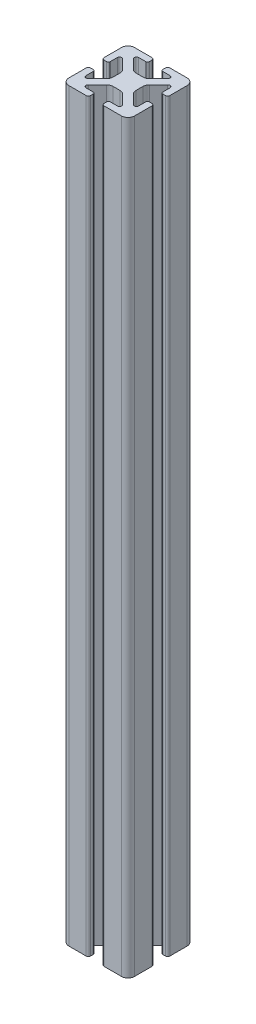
SolidWorks part; units mm, degrees
ref_plane "Front Plane" through (0, 0, 0) normal (0, 0, 1) x (1, 0, 0)
ref_plane "Top Plane" through (0, 0, 0) normal (0, 1, 0) x (1, 0, 0)
ref_plane "Right Plane" through (0, 0, 0) normal (1, 0, 0) x (0, 0, -1)
imported_body "item_0041901_Profile_6_30x30_L=20_1.stp"
sketch "Sketch1" plane through (0, 10, 0) normal (0, 1, 0) x (1, 0, 0)
  line L36 (3.1, 14) -> (3.1, 12.8)
  line L37 (3.9, 12) -> (7.1276, 12)
  line L38 (7.8506, 10.2547) -> (3.7245, 6.1287)
  line L39 (1.6032, 5.25) -> (-1.6032, 5.25)
  line L40 (-3.7245, 6.1287) -> (-7.8506, 10.2547)
  line L41 (-7.1276, 12) -> (-3.9, 12)
  line L42 (-3.1, 12.8) -> (-3.1, 14)
  line L43 (-4.1, 15) -> (-12, 15)
  line L44 (-15, 12) -> (-15, 4.1)
  line L45 (-14, 3.1) -> (-12.8, 3.1)
  line L46 (-12, 3.9) -> (-12, 7.1276)
  line L47 (-10.2547, 7.8506) -> (-6.1287, 3.7245)
  line L48 (-5.25, 1.6032) -> (-5.25, -1.6032)
  line L49 (-6.1287, -3.7245) -> (-10.2547, -7.8506)
  line L50 (-12, -7.1276) -> (-12, -3.9)
  line L51 (-12.8, -3.1) -> (-14, -3.1)
  line L52 (-15, -4.1) -> (-15, -12)
  line L53 (-12, -15) -> (-4.1, -15)
  line L54 (-3.1, -14) -> (-3.1, -12.8)
  line L55 (-3.9, -12) -> (-7.1276, -12)
  line L56 (-7.8506, -10.2547) -> (-3.7245, -6.1287)
  line L57 (-1.6032, -5.25) -> (1.6032, -5.25)
  line L58 (3.7245, -6.1287) -> (7.8506, -10.2547)
  line L59 (7.1276, -12) -> (3.9, -12)
  line L60 (3.1, -12.8) -> (3.1, -14)
  line L61 (4.1, -15) -> (12, -15)
  line L62 (15, -12) -> (15, -4.1)
  line L63 (14, -3.1) -> (12.8, -3.1)
  line L64 (12, -3.9) -> (12, -7.1276)
  line L65 (10.2547, -7.8506) -> (6.1287, -3.7245)
  line L66 (5.25, -1.6032) -> (5.25, 1.6032)
  line L67 (6.1287, 3.7245) -> (10.2547, 7.8506)
  line L68 (12, 7.1276) -> (12, 3.9)
  line L69 (12.8, 3.1) -> (14, 3.1)
  line L70 (15, 4.1) -> (15, 12)
  line L71 (12, 15) -> (4.1, 15)
  line L72 (3.1, 14) -> (3.1, 12.8)
  line L73 (3.9, 12) -> (7.1276, 12)
  line L74 (7.8506, 10.2547) -> (3.7245, 6.1287)
  line L75 (1.6032, 5.25) -> (-1.6032, 5.25)
  line L76 (-3.7245, 6.1287) -> (-7.8506, 10.2547)
  line L77 (-7.1276, 12) -> (-3.9, 12)
  line L78 (-3.1, 12.8) -> (-3.1, 14)
  line L79 (-4.1, 15) -> (-12, 15)
  line L80 (-15, 12) -> (-15, 4.1)
  line L81 (-14, 3.1) -> (-12.8, 3.1)
  line L82 (-12, 3.9) -> (-12, 7.1276)
  line L83 (-10.2547, 7.8506) -> (-6.1287, 3.7245)
  line L84 (-5.25, 1.6032) -> (-5.25, -1.6032)
  line L85 (-6.1287, -3.7245) -> (-10.2547, -7.8506)
  line L86 (-12, -7.1276) -> (-12, -3.9)
  line L87 (-12.8, -3.1) -> (-14, -3.1)
  line L88 (-15, -4.1) -> (-15, -12)
  line L89 (-12, -15) -> (-4.1, -15)
  line L90 (-3.1, -14) -> (-3.1, -12.8)
  line L91 (-3.9, -12) -> (-7.1276, -12)
  line L92 (-7.8506, -10.2547) -> (-3.7245, -6.1287)
  line L93 (-1.6032, -5.25) -> (1.6032, -5.25)
  line L94 (3.7245, -6.1287) -> (7.8506, -10.2547)
  line L95 (7.1276, -12) -> (3.9, -12)
  line L96 (3.1, -12.8) -> (3.1, -14)
  line L97 (4.1, -15) -> (12, -15)
  line L98 (15, -12) -> (15, -4.1)
  line L99 (14, -3.1) -> (12.8, -3.1)
  line L100 (12, -3.9) -> (12, -7.1276)
  line L101 (10.2547, -7.8506) -> (6.1287, -3.7245)
  line L102 (5.25, -1.6032) -> (5.25, 1.6032)
  line L103 (6.1287, 3.7245) -> (10.2547, 7.8506)
  line L104 (12, 7.1276) -> (12, 3.9)
  line L105 (12.8, 3.1) -> (14, 3.1)
  line L106 (15, 4.1) -> (15, 12)
  line L107 (12, 15) -> (4.1, 15)
  arc A36 (4.1, 15) -> (3.1, 14) centre (4.1, 14) ccw
  arc A37 (3.1, 12.8) -> (3.9, 12) centre (3.9, 12.8) ccw
  arc A38 (7.8506, 10.2547) -> (7.1276, 12) centre (7.1276, 10.9776) ccw
  arc A39 (1.6032, 5.25) -> (3.7245, 6.1287) centre (1.6032, 8.25) ccw
  arc A40 (-3.7245, 6.1287) -> (-1.6032, 5.25) centre (-1.6032, 8.25) ccw
  arc A41 (-7.1276, 12) -> (-7.8506, 10.2547) centre (-7.1276, 10.9776) ccw
  arc A42 (-3.9, 12) -> (-3.1, 12.8) centre (-3.9, 12.8) ccw
  arc A43 (-3.1, 14) -> (-4.1, 15) centre (-4.1, 14) ccw
  arc A44 (-12, 15) -> (-15, 12) centre (-12, 12) ccw
  arc A45 (-15, 4.1) -> (-14, 3.1) centre (-14, 4.1) ccw
  arc A46 (-12.8, 3.1) -> (-12, 3.9) centre (-12.8, 3.9) ccw
  arc A47 (-10.2547, 7.8506) -> (-12, 7.1276) centre (-10.9776, 7.1276) ccw
  arc A48 (-5.25, 1.6032) -> (-6.1287, 3.7245) centre (-8.25, 1.6032) ccw
  arc A49 (-6.1287, -3.7245) -> (-5.25, -1.6032) centre (-8.25, -1.6032) ccw
  arc A50 (-12, -7.1276) -> (-10.2547, -7.8506) centre (-10.9776, -7.1276) ccw
  arc A51 (-12, -3.9) -> (-12.8, -3.1) centre (-12.8, -3.9) ccw
  arc A52 (-14, -3.1) -> (-15, -4.1) centre (-14, -4.1) ccw
  arc A53 (-15, -12) -> (-12, -15) centre (-12, -12) ccw
  arc A54 (-4.1, -15) -> (-3.1, -14) centre (-4.1, -14) ccw
  arc A55 (-3.1, -12.8) -> (-3.9, -12) centre (-3.9, -12.8) ccw
  arc A56 (-7.8506, -10.2547) -> (-7.1276, -12) centre (-7.1276, -10.9776) ccw
  arc A57 (-1.6032, -5.25) -> (-3.7245, -6.1287) centre (-1.6032, -8.25) ccw
  arc A58 (3.7245, -6.1287) -> (1.6032, -5.25) centre (1.6032, -8.25) ccw
  arc A59 (7.1276, -12) -> (7.8506, -10.2547) centre (7.1276, -10.9776) ccw
  arc A60 (3.9, -12) -> (3.1, -12.8) centre (3.9, -12.8) ccw
  arc A61 (3.1, -14) -> (4.1, -15) centre (4.1, -14) ccw
  arc A62 (12, -15) -> (15, -12) centre (12, -12) ccw
  arc A63 (15, -4.1) -> (14, -3.1) centre (14, -4.1) ccw
  arc A64 (12.8, -3.1) -> (12, -3.9) centre (12.8, -3.9) ccw
  arc A65 (10.2547, -7.8506) -> (12, -7.1276) centre (10.9776, -7.1276) ccw
  arc A66 (5.25, -1.6032) -> (6.1287, -3.7245) centre (8.25, -1.6032) ccw
  arc A67 (6.1287, 3.7245) -> (5.25, 1.6032) centre (8.25, 1.6032) ccw
  arc A68 (12, 7.1276) -> (10.2547, 7.8506) centre (10.9776, 7.1276) ccw
  arc A69 (12, 3.9) -> (12.8, 3.1) centre (12.8, 3.9) ccw
  arc A70 (14, 3.1) -> (15, 4.1) centre (14, 4.1) ccw
  arc A71 (15, 12) -> (12, 15) centre (12, 12) ccw
  arc A72 (4.1, 15) -> (3.1, 14) centre (4.1, 14) ccw
  arc A73 (3.1, 12.8) -> (3.9, 12) centre (3.9, 12.8) ccw
  arc A74 (7.8506, 10.2547) -> (7.1276, 12) centre (7.1276, 10.9776) ccw
  arc A75 (1.6032, 5.25) -> (3.7245, 6.1287) centre (1.6032, 8.25) ccw
  arc A76 (-3.7245, 6.1287) -> (-1.6032, 5.25) centre (-1.6032, 8.25) ccw
  arc A77 (-7.1276, 12) -> (-7.8506, 10.2547) centre (-7.1276, 10.9776) ccw
  arc A78 (-3.9, 12) -> (-3.1, 12.8) centre (-3.9, 12.8) ccw
  arc A79 (-3.1, 14) -> (-4.1, 15) centre (-4.1, 14) ccw
  arc A80 (-12, 15) -> (-15, 12) centre (-12, 12) ccw
  arc A81 (-15, 4.1) -> (-14, 3.1) centre (-14, 4.1) ccw
  arc A82 (-12.8, 3.1) -> (-12, 3.9) centre (-12.8, 3.9) ccw
  arc A83 (-10.2547, 7.8506) -> (-12, 7.1276) centre (-10.9776, 7.1276) ccw
  arc A84 (-5.25, 1.6032) -> (-6.1287, 3.7245) centre (-8.25, 1.6032) ccw
  arc A85 (-6.1287, -3.7245) -> (-5.25, -1.6032) centre (-8.25, -1.6032) ccw
  arc A86 (-12, -7.1276) -> (-10.2547, -7.8506) centre (-10.9776, -7.1276) ccw
  arc A87 (-12, -3.9) -> (-12.8, -3.1) centre (-12.8, -3.9) ccw
  arc A88 (-14, -3.1) -> (-15, -4.1) centre (-14, -4.1) ccw
  arc A89 (-15, -12) -> (-12, -15) centre (-12, -12) ccw
  arc A90 (-4.1, -15) -> (-3.1, -14) centre (-4.1, -14) ccw
  arc A91 (-3.1, -12.8) -> (-3.9, -12) centre (-3.9, -12.8) ccw
  arc A92 (-7.8506, -10.2547) -> (-7.1276, -12) centre (-7.1276, -10.9776) ccw
  arc A93 (-1.6032, -5.25) -> (-3.7245, -6.1287) centre (-1.6032, -8.25) ccw
  arc A94 (3.7245, -6.1287) -> (1.6032, -5.25) centre (1.6032, -8.25) ccw
  arc A95 (7.1276, -12) -> (7.8506, -10.2547) centre (7.1276, -10.9776) ccw
  arc A96 (3.9, -12) -> (3.1, -12.8) centre (3.9, -12.8) ccw
  arc A97 (3.1, -14) -> (4.1, -15) centre (4.1, -14) ccw
  arc A98 (12, -15) -> (15, -12) centre (12, -12) ccw
  arc A99 (15, -4.1) -> (14, -3.1) centre (14, -4.1) ccw
  arc A100 (12.8, -3.1) -> (12, -3.9) centre (12.8, -3.9) ccw
  arc A101 (10.2547, -7.8506) -> (12, -7.1276) centre (10.9776, -7.1276) ccw
  arc A102 (5.25, -1.6032) -> (6.1287, -3.7245) centre (8.25, -1.6032) ccw
  arc A103 (6.1287, 3.7245) -> (5.25, 1.6032) centre (8.25, 1.6032) ccw
  arc A104 (12, 7.1276) -> (10.2547, 7.8506) centre (10.9776, 7.1276) ccw
  arc A105 (12, 3.9) -> (12.8, 3.1) centre (12.8, 3.9) ccw
  arc A106 (14, 3.1) -> (15, 4.1) centre (14, 4.1) ccw
  arc A107 (15, 12) -> (12, 15) centre (12, 12) ccw
  dimension "D1" = 0
extrude "Boss-Extrude1" add sketch "Sketch1" along normal blind 320
